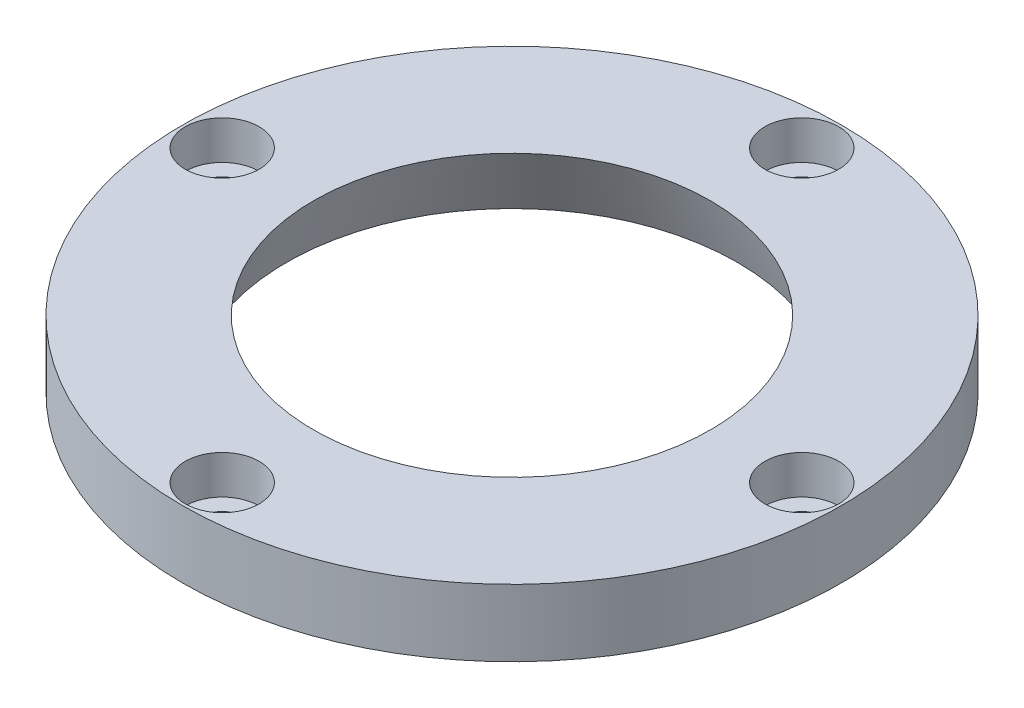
SolidWorks part; units mm, degrees
ref_plane "Plan de face" through (0, 0, 0) normal (0, 0, 1) x (1, 0, 0)
ref_plane "Plan de dessus" through (0, 0, 0) normal (0, 1, 0) x (1, 0, 0)
ref_plane "Plan de droite" through (0, 0, 0) normal (1, 0, 0) x (0, 0, -1)
sketch "Esquisse1" plane through (0, 0, 0) normal (0, 0, 1) x (1, 0, 0)
  line L0 (0, 0) -> (0, 22.3515) construction
  line L3 (-19.85, 0) -> (-29, 0)
  line L4 (-29, 0) -> (-29, 5.9)
  line L5 (-29, 5.9) -> (-17.4662, 5.9)
  line L8 (-17.4662, 5.9) -> (-19.85, 0)
  dimension "D1" = 22
  dimension "D2" = 58
  dimension "D3" = 5.9
  dimension "D4" = 39.7
revolve "Révolution1" add sketch "Esquisse1" angle 360 about L0
hole_wizard "Chambrage pour vis à tête hexagonale M31" positions "Esquisse3" profile "Esquisse2" counterbore size "M3" standard "ISO"
sketch "Esquisse3" plane through (0, 5.9, 0) normal (0, 1, 0) x (1, 0, 0)
  line L0 (0, 0) -> (0, -41.8624) construction
  point P0 (0, -25.5)
  dimension "D1" = 25.5
sketch "Esquisse2" plane through (0, 5.9, 25.5) normal (1, 0, 0) x (0, 0, 1)
  line L0 (0, 0) -> (0, 5.9)
  line L1 (0, 5.9) -> (1.7, 5.9)
  line L3 (1.7, 5.9) -> (1.7, 3.4)
  line L4 (1.7, 3.4) -> (3.25, 3.4)
  line L5 (3.25, 3.4) -> (3.25, 0)
  line L7 (3.25, 0) -> (0, 0)
  line L11 (0, -6.35) -> (0, 107.95) construction
  dimension "Diamètre du perçage jusqu'au prochain" = 3.4
  dimension "Profondeur du perçage jusqu'au prochain" = 5.9
  dimension "Diamètre du chambrage" = 6.5
  dimension "Profondeur du chambrage" = 3.4
pattern_circular "Répétition circulaire1" count 4 every 90 about axis through (0, 0, 0) along (0, 1, 0) of "Chambrage pour vis à tête hexagonale M31"
